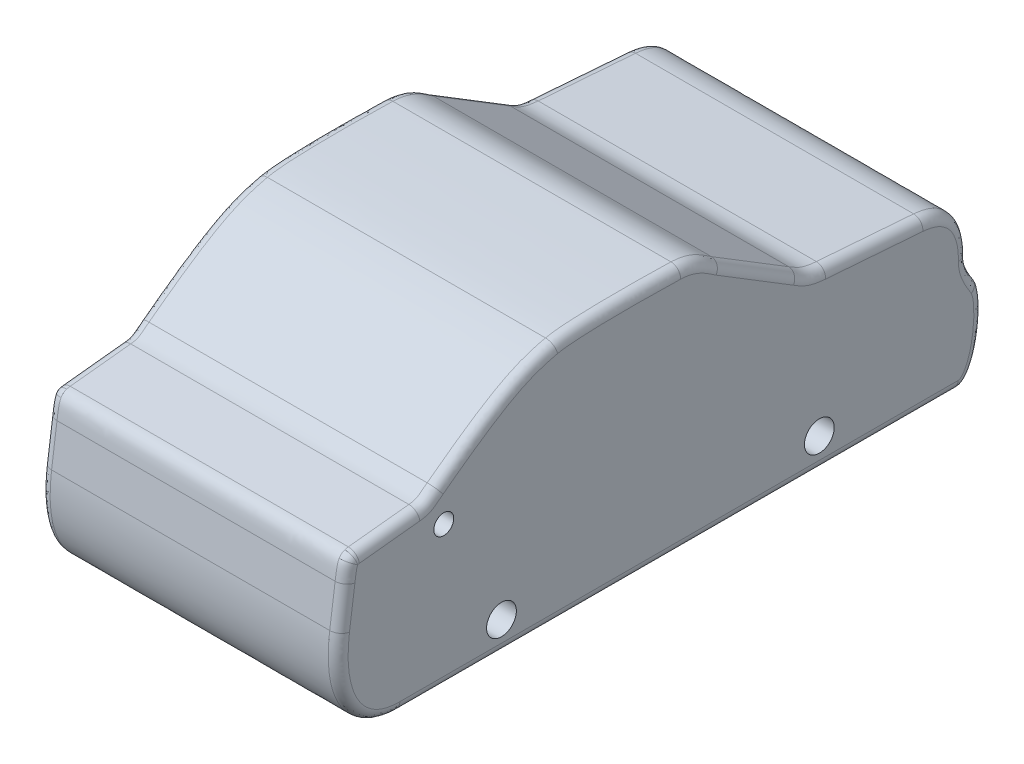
SolidWorks part; units mm, degrees
ref_plane "Front Plane" through (0, 0, 0) normal (0, 0, 1) x (1, 0, 0)
ref_plane "Top Plane" through (0, 0, 0) normal (0, 1, 0) x (1, 0, 0)
ref_plane "Right Plane" through (0, 0, 0) normal (1, 0, 0) x (0, 0, -1)
sketch "Sketch1" plane through (0, 0, 0) normal (1, 0, 0) x (0, 0, -1)
  line L0 (24.6288, 16.7187) -> (14.8301, 17.458)
  line L1 (12.0472, 18.4005) -> (4.2631, 23.1707)
  line L2 (-26.1938, 16.7932) -> (-32.2846, 16.1427)
  line L3 (-33.6147, 13.8069) -> (-34.1598, 9.7855)
  line L4 (-28.1013, 0.0489) -> (28.1013, -0.0489)
  circle A0 centre (-17.8687, 3.0983) radius 1.5
  circle A1 centre (14.1313, 3.0983) radius 1.5
  ellipse E0 centre (-17.8687, 3.0983) end of major axis (-19.3687, 3.0983) minor radius 1.5 construction
  ellipse E1 centre (14.1313, 3.0983) end of major axis (12.6313, 3.0983) minor radius 1.5 construction
  ellipse E2 centre (-23.6753, 14.3176) end of major axis (-24.6754, 14.3176) minor radius 1 construction
  spline S0 degree 3 poles (14.8301, 17.458) (13.3007, 17.5734) (12.7991, 17.9398) (12.0472, 18.4005) knots 0.066667 0.066667 0.066667 0.066667 0.133333 0.133333 0.133333 0.133333
  spline S1 degree 3 poles (4.2631, 23.1707) (3.5069, 23.6342) (2.3549, 24.6832) (0.1946, 24.7508) knots 0.2 0.2 0.2 0.2 0.266667 0.266667 0.266667 0.266667
  spline S2 degree 3 poles (0.1946, 24.7508) (-1.9658, 24.8184) (-10.0424, 24.9766) (-12.438, 24.4349) knots 0.266667 0.266667 0.266667 0.266667 0.333333 0.333333 0.333333 0.333333
  spline S3 degree 3 poles (-12.438, 24.4349) (-15.2787, 23.7923) (-17.601, 22.8466) (-24.3524, 17.7624) knots 0.333333 0.333333 0.333333 0.333333 0.4 0.4 0.4 0.4
  spline S4 degree 3 poles (-24.3524, 17.7624) (-25.3234, 17.0315) (-25.3371, 16.8845) (-26.1938, 16.7932) knots 0.4 0.4 0.4 0.4 0.466667 0.466667 0.466667 0.466667
  spline S5 degree 3 poles (-32.2846, 16.1427) (-33.3108, 16.0334) (-33.4063, 15.3447) (-33.6147, 13.8069) knots 0.533333 0.533333 0.533333 0.533333 0.6 0.6 0.6 0.6
  spline S6 degree 3 poles (-34.1598, 9.7855) (-34.8841, 4.4411) (-32.9763, 0.0568) (-28.1013, 0.0489) knots 0.666667 0.666667 0.666667 0.666667 0.733333 0.733333 0.733333 0.733333
  spline S7 degree 3 poles (28.1013, -0.0489) (30.6135, -0.0531) (31.2125, 6.9985) (30.2684, 8.4231) knots 0.8 0.8 0.8 0.8 0.866667 0.866667 0.866667 0.866667
  spline S8 degree 3 poles (30.2684, 8.4231) (29.5139, 9.5618) (29.1163, 10.4761) (29.1372, 11.2958) knots 0.866667 0.866667 0.866667 0.866667 0.933333 0.933333 0.933333 0.933333
  spline S9 degree 3 poles (29.1372, 11.2958) (29.1798, 12.96) (28.7373, 16.4086) (24.6288, 16.7187) knots 0.933333 0.933333 0.933333 0.933333 1 1 1 1
extrude "Boss-Extrude1" add sketch "Sketch1" along normal mid plane 30 contours S8 S9 L0 S0 L1 S1 S2 S3 S4 L2 S5 L3 S6 L4 S7 E0 E1 E2 | E2
fillet "Fillet1" radius 1 26 edges at (-15, 20.7856, -8.1551) (-15, 17.0884, -19.7295) (-15, 0, 0) (-15, 11.7962, 33.8872) (15, 17.0884, -19.7295) (15, 0, 0) (15, 11.7962, 33.8872) (15, 16.468, 29.2392) (-15, 16.468, 29.2392) (15, 20.7856, -8.1551)
sketch "Sketch2" plane through (15, 0, 0) normal (1, 0, 0) x (0, 0, -1)
  circle A0 centre (-23.6753, 14.3176) radius 1
extrude "Cut-Extrude1" cut sketch "Sketch2" against normal blind 28
